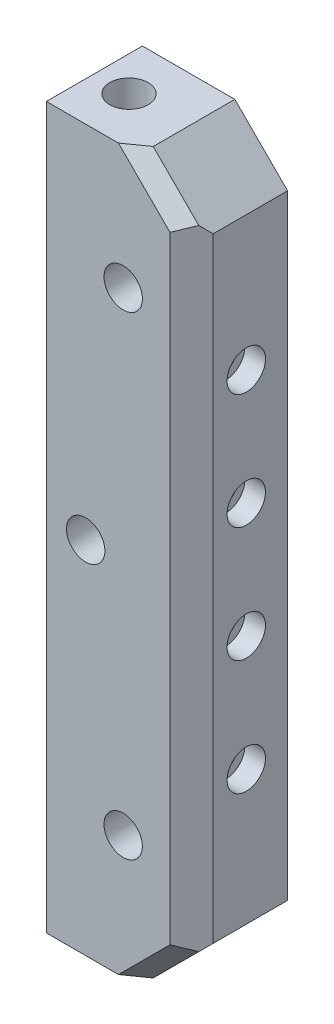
SolidWorks part; units mm, degrees
ref_plane "Přední rovina" through (0, 0, 0) normal (0, 0, 1) x (1, 0, 0)
ref_plane "Horní rovina" through (0, 0, 0) normal (0, 1, 0) x (1, 0, 0)
ref_plane "Pravá rovina" through (0, 0, 0) normal (1, 0, 0) x (0, 0, -1)
sketch "Skica1" plane through (0, 0, 0) normal (0, 0, 1) x (1, 0, 0)
  line L1 (0, 0) -> (30.25, 0)
  line L2 (0, 0) -> (0, 150)
  line L3 (0, 150) -> (30.25, 150)
  line L4 (30.25, 0) -> (30.25, 150)
  dimension "D1" = 30.25
  dimension "D2" = 150
extrude "Vysunout1" add sketch "Skica1" along normal blind 20
chamfer "Zkosit1" distance 11 angle 45 2 edges at (30.25, 150, 10) (30.25, 0, 10)
chamfer "Zkosit2" distance 4.5 angle 45 1 edges at (30.25, 75, 20)
chamfer "Zkosit3" distance 3 angle 45 2 edges at (22.5, 146.75, 20) (22.5, 3.25, 20)
sketch "Skica2" plane through (0, 0, 0) normal (-1, 0, 0) x (0, 0, 1)
  line L0 (20, 0) -> (0, 0) construction
  line L1 (12.57, 125) -> (17.8, 125)
  line L2 (12.57, 125) -> (12.57, 0)
  line L3 (12.57, 0) -> (17.8, 0)
  line L4 (17.8, 125) -> (17.8, 0)
  line L5 (20, 150) -> (20, 0) construction
  dimension "D1" = 5.23
  dimension "D2" = 2.2
extrude "Odebrat vysunutím2" cut sketch "Skica2" against normal blind 1.4
sketch "Skica4" plane through (30.25, 0, 0) normal (1, 0, 0) x (0, 0, -1)
  line L0 (0, 75) -> (-20, 75) construction
  line L1 (0, 11) -> (0, 139) construction
  line L2 (-20, 10.7426) -> (-20, 139.2574) construction
  circle A0 centre (-8.6121, 87) radius 4
  circle A1 centre (-8.6121, 111) radius 4
  circle A2 centre (-8.6121, 39) radius 4
  circle A3 centre (-8.6121, 63) radius 4
  dimension "D1" = 8
  dimension "D3" = 24
  dimension "D2" = 12
extrude "Odebrat vysunutím3" cut sketch "Skica4" against normal blind 4.3
sketch "Skica5" plane through (25.95, 0, 0) normal (1, 0, 0) x (0, 0, -1)
  circle A0 centre (-8.6121, 39) radius 2.2
  circle A1 centre (-8.6121, 63) radius 2.2
  circle A2 centre (-8.6121, 87) radius 2.2
  circle A3 centre (-8.6121, 111) radius 2.2
  dimension "D1" = 4.4
extrude "Odebrat vysunutím4" cut sketch "Skica5" against normal through all
sketch "Skica6" plane through (0, 0, 20) normal (0, 0, 1) x (1, 0, 0)
  line L0 (0, 75) -> (30.25, 75) construction
  line L1 (0, 150) -> (0, 0) construction
  line L2 (30.25, 139) -> (30.25, 11) construction
  circle A0 centre (8.1853, 75) radius 4
  circle A1 centre (16, 124.3855) radius 4
  circle A2 centre (16, 25.6145) radius 4
  dimension "D1" = 8
  dimension "D2" = 50
  dimension "D3" = 16
extrude "Odebrat vysunutím5" cut sketch "Skica6" against normal blind 14
sketch "Skica3" plane through (0, 0, 0) normal (0, -1, 0) x (1, 0, 0)
  line L1 (0, 0) -> (19.25, 0) construction
  line L2 (0, 20) -> (0, 0) construction
  circle A0 centre (7.2, 10) radius 4
  dimension "D1" = 8
  dimension "D2" = 7.2
  dimension "D3" = 10
extrude "Odebrat vysunutím1" cut sketch "Skica3" against normal blind 10
ref_plane "Rovina1" through (0, 75, 0) normal (0, 1, 0) x (-1, 0, 0)
mirror "Zrcadlit1" about plane through (0, 75, 0) normal (0, 1, 0) of "Odebrat vysunutím1"
